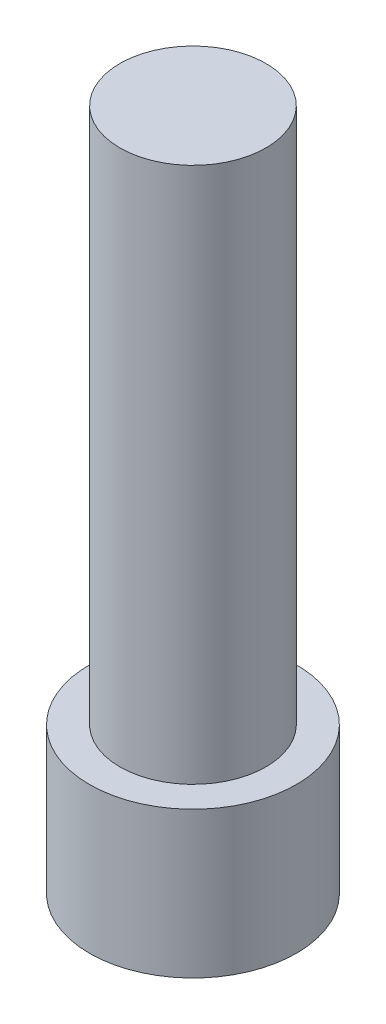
SolidWorks part; units mm, degrees
ref_plane "前视基准面" through (0, 0, 0) normal (0, 0, 1) x (1, 0, 0)
ref_plane "上视基准面" through (0, 0, 0) normal (0, 1, 0) x (1, 0, 0)
ref_plane "右视基准面" through (0, 0, 0) normal (1, 0, 0) x (0, 0, -1)
other "Configuration Table"
sketch "草图1" plane through (0, 0, 0) normal (0, 1, 0) x (1, 0, 0)
  circle A0 centre (0, 0) radius 4.25
  dimension "D1" = 8.5
extrude "凸台-拉伸1" add sketch "草图1" along normal blind 6
sketch "草图2" plane through (0, 6, 0) normal (0, 1, 0) x (1, 0, 0)
  circle A0 centre (0, 0) radius 3
  dimension "D1" = 6
extrude "凸台-拉伸2" add sketch "草图2" along normal blind 22
sketch "草图3" plane through (0, 0, 0) normal (0, -1, 0) x (1, 0, 0)
  line L1 (2.3571, -1.6665) -> (2.6218, 1.2081)
  line L2 (2.6218, 1.2081) -> (0.2647, 2.8746)
  line L3 (0.2647, 2.8746) -> (-2.3571, 1.6665)
  line L4 (-2.3571, 1.6665) -> (-2.6218, -1.2081)
  line L5 (-2.6218, -1.2081) -> (-0.2647, -2.8746)
  line L6 (-0.2647, -2.8746) -> (2.3571, -1.6665)
  circle A0 centre (0, 0) radius 2.5 construction
  dimension "D1" = 5
extrude "切除-拉伸1" cut sketch "草图3" against normal blind 3
